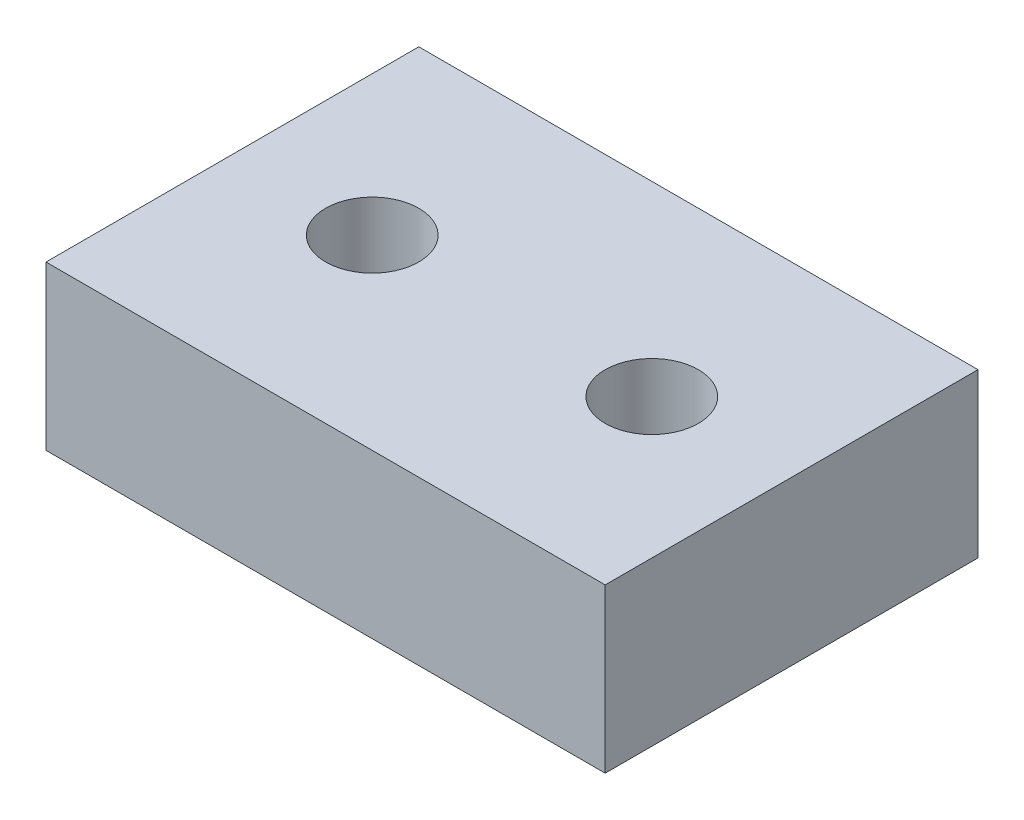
SolidWorks part; units mm, degrees
ref_plane "front" through (0, 0, 0) normal (0, 0, 1) x (1, 0, 0)
ref_plane "top" through (0, 0, 0) normal (0, 1, 0) x (1, 0, 0)
ref_plane "side" through (0, 0, 0) normal (1, 0, 0) x (0, 0, -1)
sketch "Sketch1"
  dimension "D1" = 76.2
  dimension "D2" = 22.225
extrude "Base-Extrude" add sketch "Sketch1" along normal blind 50.8
sketch "Sketch2"
  dimension "D1" = 12.7
  dimension "D2" = 19.05
  dimension "D3" = 19.05
extrude "Cut-Extrude1" cut sketch "Sketch2" against normal through all
